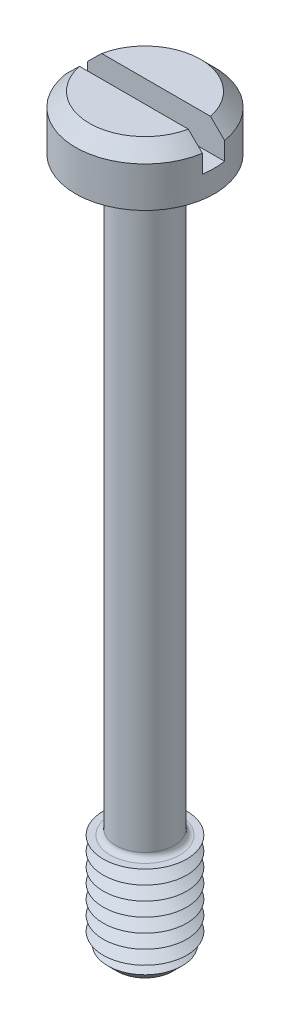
SolidWorks part; units mm, degrees
ref_plane "Front Plane" through (0, 0, 0) normal (0, 0, 1) x (1, 0, 0)
ref_plane "Top Plane" through (0, 0, 0) normal (0, 1, 0) x (1, 0, 0)
ref_plane "Right Plane" through (0, 0, 0) normal (1, 0, 0) x (0, 0, -1)
sketch "Sketch1" plane through (0, 0, 0) normal (0, 1, 0) x (1, 0, 0)
  circle A0 centre (0, 0) radius 5
  dimension "D1" = 10
extrude "Boss-Extrude1" add sketch "Sketch1" along normal blind 3.9
sketch "Sketch2" plane through (0, 0, 0) normal (0, -1, 0) x (1, 0, 0)
  circle A0 centre (0, 0) radius 2.1
  dimension "D1" = 4.2
extrude "Boss-Extrude2" add sketch "Sketch2" along normal blind 50
sketch "Sketch3" plane through (0, -50, 0) normal (0, -1, 0) x (1, 0, 0)
  circle A0 centre (0, 0) radius 3
  dimension "D1" = 6
extrude "Boss-Extrude3" add sketch "Sketch3" against normal blind 7.5
chamfer "Chamfer1" distance 1 angle 45 1 edges at (0, -50, -3)
sketch "Sketch4" plane through (0, 0, 0) normal (1, 0, 0) x (0, 0, -1)
  line L0 (0, -6.5871) -> (0, -12.0372) construction
sketch "Sketch5" plane through (0, 0, 0) normal (1, 0, 0) x (0, 0, -1)
  line L0 (-3, -42.5) -> (-2.134, -43)
  line L1 (-2.134, -43) -> (-3, -43.5)
  line L2 (-3, -42.5) -> (-3, -49) construction
  line L3 (-3, -43.5) -> (-3, -42.5)
  dimension "D1" = 1
revolve "Cut-Revolve1" cut sketch "Sketch5" angle 360 about L0
pattern_linear "LPattern1" count 7 spacing 1 along (0, -1, 0) of "Cut-Revolve1"
fillet "Fillet1" radius 0.4 2 edges at (0, -42.5, -2.1) (0, 0, -2.1)
chamfer "Chamfer2" distance 1 angle 45 1 edges at (0, 3.9, 5)
sketch "Sketch6" plane through (0, 3.9, 0) normal (0, 1, 0) x (1, 0, 0)
  line L1 (5, -0.8) -> (-5, -0.8)
  line L2 (5, -0.8) -> (5, 0.8)
  line L3 (5, 0.8) -> (-5, 0.8)
  line L4 (-5, -0.8) -> (-5, 0.8)
  line L5 (5, -0.8) -> (-5, 0.8) construction
  line L6 (5, 0.8) -> (-5, -0.8) construction
  circle A0 centre (0, 0) radius 5 construction
  point P0 (0, 0)
  dimension "D1" = 1.6
extrude "Cut-Extrude1" cut sketch "Sketch6" against normal blind 2.3
